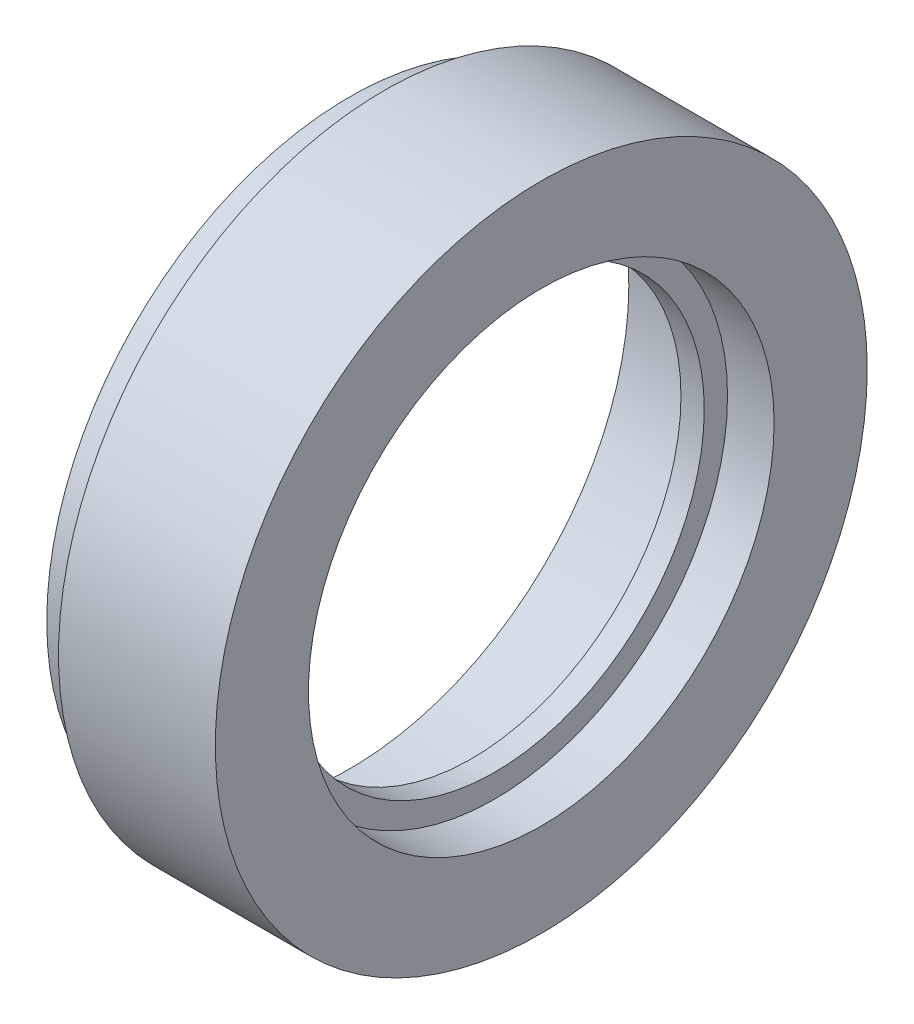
SolidWorks part; units mm, degrees
ref_plane "Front Plane" through (0, 0, 0) normal (0, 0, 1) x (1, 0, 0)
ref_plane "Top Plane" through (0, 0, 0) normal (0, 1, 0) x (1, 0, 0)
ref_plane "Right Plane" through (0, 0, 0) normal (1, 0, 0) x (0, 0, -1)
sketch "Sketch1" plane through (0, 0, 0) normal (0, 0, 1) x (1, 0, 0)
  line L15 (0, 41.275) -> (0, 38.1)
  line L16 (0, 0) -> (-23.3271, 0) construction
  line L18 (0, 41.275) -> (4.7752, 41.275)
  line L21 (0, 38.1) -> (16.637, 38.1)
  line L23 (4.7752, 44.45) -> (4.7752, 41.275)
  line L24 (16.637, 38.1) -> (16.637, 28.575)
  line L25 (16.637, 28.575) -> (19.812, 28.575)
  line L26 (19.812, 28.575) -> (19.812, 31.75)
  line L27 (19.812, 31.75) -> (26.162, 31.75)
  line L28 (26.162, 31.75) -> (26.162, 44.45)
  line L29 (4.7752, 44.45) -> (26.162, 44.45)
  dimension "D1" = 76.2
  dimension "D2" = 82.55
  dimension "D3" = 88.9
  dimension "D4" = 4.7752
  dimension "D5" = 57.15
  dimension "D6" = 6.35
  dimension "D7" = 3.175
  dimension "D8" = 15.0368
  dimension "D9" = 63.5
revolve "Revolve1" add sketch "Sketch1" angle 360 about L16
